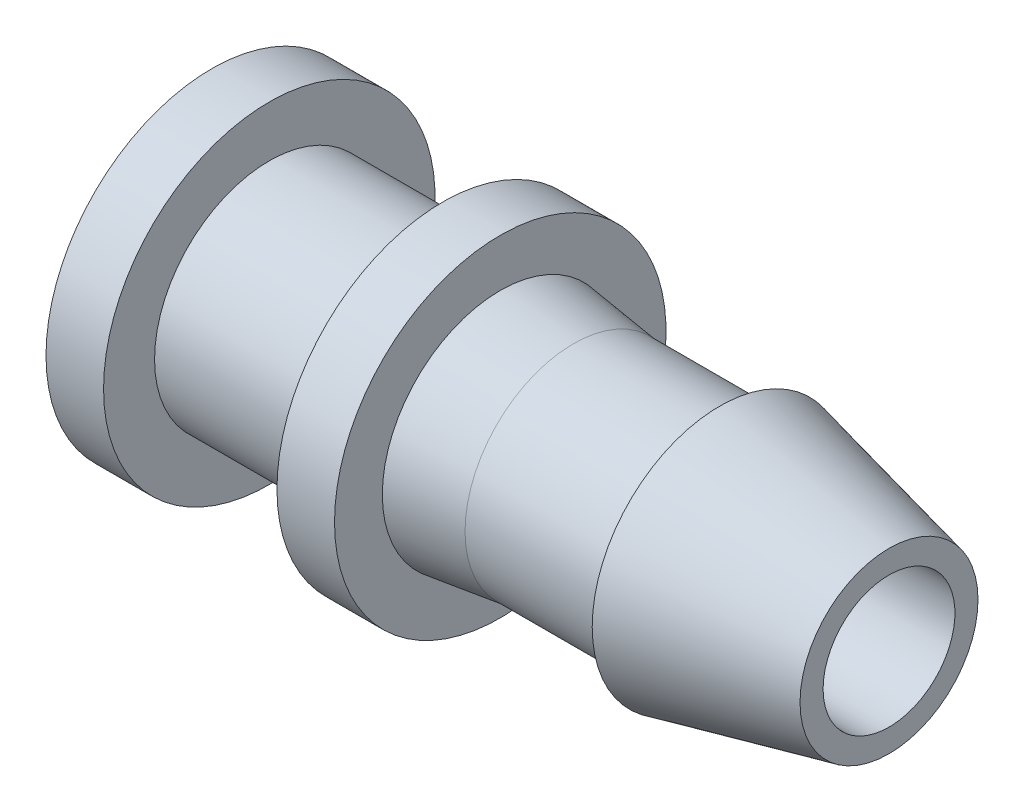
SolidWorks part; units mm, degrees
ref_plane "Front Plane" through (0, 0, 0) normal (0, 0, 1) x (1, 0, 0)
ref_plane "Top Plane" through (0, 0, 0) normal (0, 1, 0) x (1, 0, 0)
ref_plane "Right Plane" through (0, 0, 0) normal (1, 0, 0) x (0, 0, -1)
sketch "Sketch1" plane through (0, 0, 0) normal (0, 0, 1) x (1, 0, 0)
  line L0 (0, 0) -> (18.6905, 0) construction
  line L1 (18.6905, 2.3114) -> (18.6905, 3.1204)
  line L2 (18.6905, 3.1204) -> (12.7532, 4.4704)
  line L3 (12.7532, 4.4704) -> (12.7532, 3.7998)
  line L4 (12.7532, 3.7998) -> (7.6234, 3.7998)
  line L5 (7.6234, 3.7998) -> (5.0585, 4.1351)
  line L6 (5.0585, 4.1351) -> (5.0585, 5.8115)
  line L7 (5.0585, 5.8115) -> (3.0399, 5.8115)
  line L8 (3.0399, 5.8115) -> (3.0399, 4.0234)
  line L9 (3.0399, 4.0234) -> (-3.0399, 4.0234)
  line L10 (18.6905, 2.3114) -> (-3.0399, 2.3114)
  line L11 (0, 0.5334) -> (0, 4.0234) construction
  line L12 (5.0585, 4.1351) -> (12.7532, 4.1351) construction
  line L13 (0, 0) -> (0, -2.6412) construction
  line L14 (5.0585, 3.7961) -> (7.6234, 3.7961) construction
  line L15 (7.6234, 4.3595) -> (10.1883, 4.3595) construction
  line L16 (10.1883, 4.0918) -> (12.7532, 4.0918) construction
  line L17 (-3.0399, 5.8115) -> (-3.0399, 4.0234)
  line L18 (-5.0585, 5.8115) -> (-3.0399, 5.8115)
  line L19 (-5.0585, 0) -> (-5.0585, 5.8115)
  line L20 (-5.0585, 0) -> (-3.0399, 0)
  line L21 (-3.0399, 0) -> (-3.0399, 2.3114)
revolve "Revolve1" add sketch "Sketch1" angle 360 about L0
equation "\"D1@Sketch1\" = \"A@Sketch1\"*1.35"
equation "\"D3@Sketch1\" = \"C@Sketch1\"*.25"
equation "\"D4@Sketch1\" = \"C@Sketch1\"*.085"
equation "\"D6@Sketch1\" = \"C@Sketch1\"*.128"
equation "\"D2@Sketch1\" = \"B@Sketch1\"*.85"
equation "\"D5@Sketch1\" = \"B@Sketch1\"*1.30"
equation "\"D7@Sketch1\" = \"B@Sketch1\"*.9"
